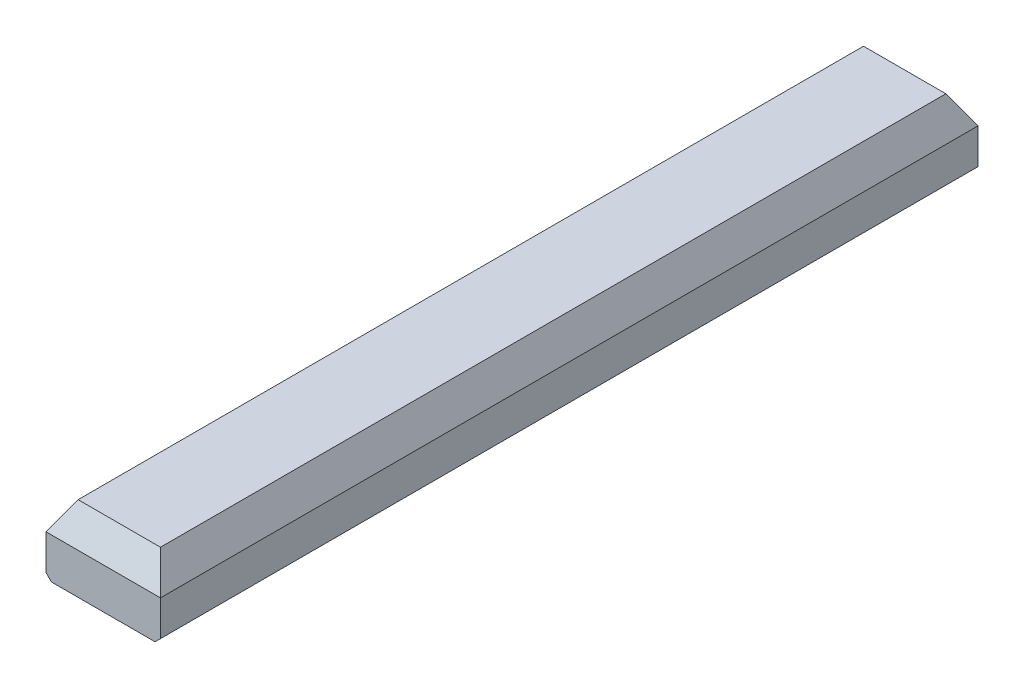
SolidWorks part; units mm, degrees
ref_plane "Front Plane" through (0, 0, 0) normal (1, 0, 0) x (0, 1, 0)
ref_plane "Top Plane" through (0, 0, 0) normal (0, 0, 1) x (0, 1, 0)
ref_plane "Right Plane" through (0, 0, 0) normal (0, 1, 0) x (-1, 0, 0)
sketch "sk W193" plane through (0, 0, 0) normal (0, 0, 1) x (0, 1, 0)
  point P0 (-210.82, -196.596)
  point P3 (0, 0)
  line B0 (-210.82, -196.596) -> (-210.82, -160.02)
  line B1 (-210.82, -160.02) -> (-37.846, -160.02)
  line B2 (-22.606, -144.78) -> (-22.606, 144.78)
  line B3 (-37.846, 160.02) -> (-210.82, 160.02)
  line B4 (-210.82, 160.02) -> (-210.82, 196.596)
  line B5 (-210.82, 196.596) -> (188.214, 196.596)
  line B6 (188.214, 196.596) -> (188.214, 160.02)
  line B7 (188.214, 160.02) -> (15.24, 160.02)
  line B8 (0, 144.78) -> (0, -144.78)
  line B9 (15.24, -160.02) -> (188.214, -160.02)
  line B10 (188.214, -160.02) -> (188.214, -196.596)
  line B11 (188.214, -196.596) -> (-210.82, -196.596)
  arc B12 (-37.846, -160.02) -> (-22.606, -144.78) centre (-37.846, -144.78) ccw
  arc B13 (-22.606, 144.78) -> (-37.846, 160.02) centre (-37.846, 144.78) ccw
  arc B14 (15.24, 160.02) -> (0, 144.78) centre (15.24, 144.78) ccw
  arc B15 (0, -144.78) -> (15.24, -160.02) centre (15.24, -144.78) ccw
sketch_block_instance "w14x193-2"
sketch_block "w14x193" parameters "D4"=15.24, "D1"=399.034, "D2"=393.192, "D3"=22.606, "D5"=36.576
sketch "Sketch2" plane through (0, 0, 0) normal (0, 0, 1) x (0, 1, 0)
  line L0 (191.389, 158.4325) -> (1.5875, 158.4325)
  line L1 (1.5875, 158.4325) -> (1.5875, -158.4325)
  line L2 (1.5875, -158.4325) -> (191.389, -158.4325)
  line L3 (191.389, -158.4325) -> (191.389, 158.4325)
  line L4 (0, 144.78) -> (0, -144.78) construction
  line L5 (188.214, 160.02) -> (15.24, 160.02) construction
  line L6 (15.24, -160.02) -> (188.214, -160.02) construction
  line L7 (188.214, 196.596) -> (188.214, 160.02) construction
  dimension "D1" = 1.5875
  dimension "D2" = 1.5875
  dimension "D3" = 1.5875
  dimension "D4" = 3.175
extrude "Boss-Extrude1" add sketch "Sketch2" along normal mid plane 2263.1
chamfer "Chamfer1" distance 15 angle 45 2 edges at (-158.4325, 1.5875, 0) (158.4325, 1.5875, 0)
chamfer "Chamfer2" distance 44.45 angle 60 4 edges at (158.4325, 191.389, 0) (0, 191.389, 1131.55) (-158.4325, 191.389, 0) (0, 191.389, -1131.55)
